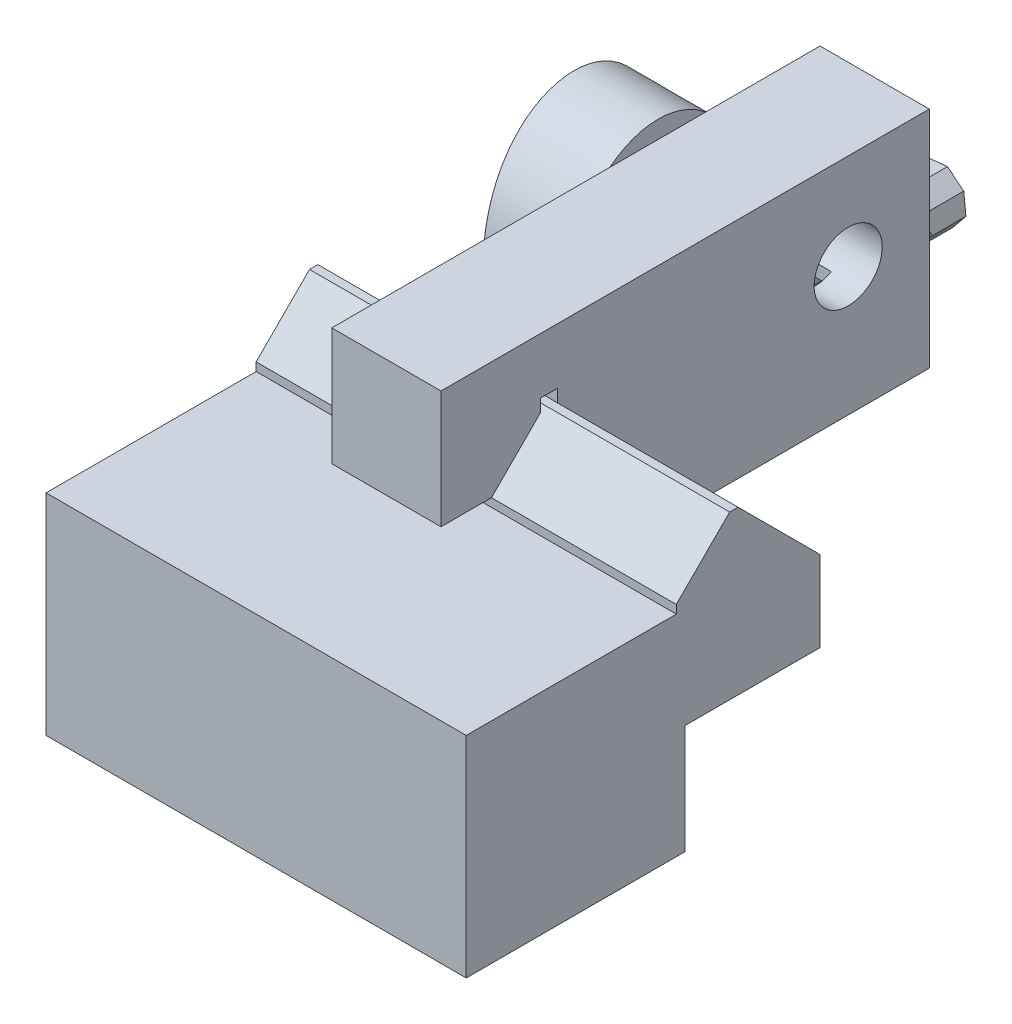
SolidWorks part; units mm, degrees
ref_plane "Top Plane" through (0, 0, 0) normal (0, 0, 1) x (1, 0, 0)
ref_plane "Front Plane" through (0, 0, 0) normal (0, 1, 0) x (1, 0, 0)
ref_plane "Right Plane" through (0, 0, 0) normal (1, 0, 0) x (0, 0, -1)
sketch "Sketch1" plane through (0, 0, 0) normal (1, 0, 0) x (0, 0, -1)
  line L0 (12.5, 12.5) -> (12.5, 13.5)
  line L7 (-12.5, 12.5) -> (12.5, 12.5)
  line L16 (-12.5, 12.5) -> (-12.5, -12.5)
  line L17 (-12.5, -12.5) -> (12.5, -12.5)
  line L18 (12.5, 12.5) -> (12.5, -12.5) construction
  line L19 (-12.5, 12.5) -> (12.5, -12.5) construction
  line L20 (-12.5, -12.5) -> (12.5, 12.5) construction
  line L21 (12.5, 13.5) -> (18.8489, 19.8489)
  line L22 (18.8489, 19.8489) -> (19.8489, 19.8489)
  line L23 (19.8489, 19.8489) -> (29.6019, 10.0958)
  line L24 (29.6019, 10.0958) -> (29.6019, 0.4958)
  line L25 (29.6019, 0.4958) -> (13.5519, 0.4958)
  line L26 (13.5519, 0.4958) -> (13.5519, -12.5)
  line L27 (12.5, -12.5) -> (13.5519, -12.5)
  line L28 (12.5, 13.5) -> (11.5, 12.5) construction
  line L29 (39.4519, 10.0958) -> (60.9519, 10.0958)
  line L30 (50.2019, 10.0958) -> (50.2019, 37.0743) construction
  line L31 (39.4519, 27.6363) -> (39.4519, -21.1762) construction
  line L32 (29.6019, 10.0958) -> (88.1638, 10.0958) construction
  spline S0 degree 3 poles (39.4519, 10.0958) (40.0358, 29.1067) (60.3681, 29.7517) (60.9519, 10.0958) knots 0 0 0 0 1 1 1 1
  point P1 (0, 0)
  point P20 (0, 0)
  dimension "D1" = 11.1
  dimension "D2" = 90
  dimension "D3" = 14.5
  dimension "D4" = 9.6
  dimension "D5" = 16.05
  dimension "D6" = 1
  dimension "D7" = 1
  dimension "D8" = 135
  dimension "D9" = 25
  dimension "D10" = 14.5
  dimension "D11" = 21.5
  dimension "D12" = 9.85
extrude "Boss-Extrude1" add sketch "Sketch1" against normal blind 10
sketch "Sketch2" plane through (0, 0, 0) normal (1, 0, 0) x (0, 0, -1)
  line L10 (-12.5, -12.5) -> (13.5519, -12.5)
  line L11 (13.5519, -12.5) -> (13.5519, 0.4958)
  line L12 (13.5519, 0.4958) -> (29.6019, 0.4958)
  line L13 (29.6019, 0.4958) -> (29.6019, 10.0958)
  line L14 (29.6019, 10.0958) -> (19.8489, 19.8489)
  line L15 (19.8489, 19.8489) -> (18.8489, 19.8489)
  line L16 (18.8489, 19.8489) -> (12.5, 13.5)
  line L17 (12.5, 13.5) -> (12.5, 12.5)
  line L18 (12.5, 12.5) -> (-12.5, 12.5)
  line L19 (-12.5, 12.5) -> (-12.5, -12.5)
  line L20 (-12.5, -12.5) -> (13.5519, -12.5)
  line L21 (13.5519, -12.5) -> (13.5519, 0.4958)
  line L22 (13.5519, 0.4958) -> (29.6019, 0.4958)
  line L23 (29.6019, 0.4958) -> (29.6019, 10.0958)
  line L24 (29.6019, 10.0958) -> (19.8489, 19.8489)
  line L25 (19.8489, 19.8489) -> (18.8489, 19.8489)
  line L26 (18.8489, 19.8489) -> (12.5, 13.5)
  line L27 (12.5, 13.5) -> (12.5, 12.5)
  line L28 (12.5, 12.5) -> (-12.5, 12.5)
  line L29 (-12.5, 12.5) -> (-12.5, -12.5)
  dimension "D1" = 0
extrude "Boss-Extrude2" add sketch "Sketch2" along normal blind 40
ref_plane "Plane1" through (5, 0, 0) normal (1, 0, 0) x (0, 0, -1)
sketch "Sketch3" plane through (5, 0, 0) normal (1, 0, 0) x (0, 0, -1)
  line L1 (39.4519, 10.0958) -> (60.9519, 10.0958)
  line L2 (39.4519, 10.0958) -> (60.9519, 10.0958) construction
  line L3 (6.5, 13.5) -> (6.5, 27.5)
  line L4 (6.5, 27.5) -> (64.6019, 27.5)
  line L6 (29.6019, 10.0958) -> (19.8489, 19.8489) construction
  line L10 (-12.5, 12.5) -> (-12.5, -12.5)
  line L11 (-12.5, -12.5) -> (13.5519, -12.5)
  line L12 (13.5519, -12.5) -> (13.5519, 0.4958)
  line L13 (13.5519, 0.4958) -> (29.6019, 0.4958)
  line L14 (29.6019, 0.4958) -> (29.6019, 10.0958)
  line L15 (29.6019, 10.0958) -> (19.8489, 19.8489)
  line L16 (19.8489, 19.8489) -> (18.8489, 19.8489)
  line L17 (18.8489, 19.8489) -> (12.5, 13.5)
  line L18 (12.5, 13.5) -> (12.5, 12.5)
  line L19 (12.5, 12.5) -> (-12.5, 12.5)
  line L20 (-12.5, 12.5) -> (-12.5, -12.5) construction
  line L21 (-12.5, -12.5) -> (13.5519, -12.5) construction
  line L22 (13.5519, -12.5) -> (13.5519, 0.4958) construction
  line L23 (13.5519, 0.4958) -> (29.6019, 0.4958) construction
  line L24 (29.6019, 0.4958) -> (29.6019, 10.0958) construction
  line L25 (29.6019, 10.0958) -> (19.8489, 19.8489) construction
  line L26 (19.8489, 19.8489) -> (18.8489, 19.8489) construction
  line L27 (18.8489, 19.8489) -> (12.5, 13.5) construction
  line L28 (12.5, 13.5) -> (12.5, 12.5) construction
  line L29 (12.5, 12.5) -> (-12.5, 12.5) construction
  line L30 (29.6019, 10.0958) -> (29.6019, 0.7958)
  line L31 (29.6019, 0.7958) -> (64.6019, 0.7958)
  line L32 (64.6019, 0.7958) -> (64.6019, 27.5)
  line L34 (12.5, 13.5) -> (6.5, 13.5)
  line L36 (18.3489, 19.3489) -> (18.3489, 20.8489)
  line L38 (29.6019, 10.0958) -> (20.3489, 19.3489)
  line L39 (20.3489, 19.3489) -> (20.3489, 20.8489)
  line L40 (19.3489, 19.8489) -> (19.3489, 21.4507) construction
  line L41 (18.3489, 20.8489) -> (19.3489, 20.8489)
  line L42 (19.3489, 20.8489) -> (20.3489, 20.8489)
  line L43 (12.5, 13.5) -> (18.3489, 19.3489)
  circle A0 centre (54.9519, 16.0958) radius 4.05
  spline S1 degree 3 poles (-5602.293, -1875.6467) (5973.4925, 861.5399) (-5925.3022, 272.9298) (5853.6063, -1331.3264) knots -4.781302 -4.781302 -4.781302 -4.781302 5.827 5.827 5.827 5.827 only from (60.9519, 10.0958) to (39.4519, 10.0958)
  spline S2 degree 3 poles (60.9519, 10.0958) (60.3681, 29.7517) (40.0358, 29.1067) (39.4519, 10.0958) knots 0 0 0 0 1 1 1 1 construction
  dimension "D3" = 8.1
  dimension "D4" = 6
  dimension "D5" = 6
  dimension "D6" = 1
  dimension "D7" = 2
  dimension "D8" = 1
  dimension "D9" = 35
  dimension "D10" = 0.3
  dimension "D11" = 14
  dimension "D12" = 6
  dimension "D1" = 0
  dimension "D2" = 0
extrude "Boss-Extrude3" add sketch "Sketch3" along normal blind 13 separate body
sketch "Sketch4" plane through (0, 0.7958, 0) normal (0, -1, 0) x (1, 0, 0)
  line L0 (18, -59.0019) -> (18, -50.9019) construction
  line L1 (18, -59.0019) -> (18, -50.9019) construction
  line L3 (14, -52.9519) -> (5, -52.9519)
  line L4 (14, -52.9519) -> (14, -56.9519)
  line L5 (14, -56.9519) -> (5, -56.9519)
  line L6 (5, -52.9519) -> (5, -56.9519)
  line L7 (13.3742, -54.9519) -> (5.6258, -54.9519) construction
  line L8 (9.5, -52.9519) -> (9.5, -54.9519) construction
  line L9 (9.5, -54.9519) -> (9.5, -56.9519) construction
  line L11 (5, -29.6019) -> (5, -64.6019) construction
  point P6 (7.3699, -56.9519)
  point P12 (0, 0)
  point P14 (18, -54.9519)
  dimension "D1" = 4
  dimension "D2" = 4
extrude "Cut-Extrude1" cut sketch "Sketch4" against normal up to surface (11.7783 mm away)
sketch "Sketch5" plane through (5, 0, 0) normal (1, 0, 0) x (0, 0, -1)
  line L1 (52.9519, 19.6176) -> (52.9519, 0.7958) construction
  line L2 (56.9519, 19.6176) -> (56.9519, 0.7958) construction
  line L3 (52.9519, 19.6176) -> (52.9519, 0.7958) construction
  line L4 (64.6019, 0.7958) -> (64.6019, 27.5) construction
  line L6 (64.6019, 11.0458) -> (48.9519, 11.0458)
  line L11 (64.6019, 11.0458) -> (64.6019, 8.0458)
  line L12 (64.6019, 8.0458) -> (48.9519, 8.0458)
  line L13 (48.9519, 11.0458) -> (48.9519, 8.0458)
  line L14 (63.1124, 12.0458) -> (43.0318, 12.0458) construction
  arc A0 (52.9519, 12.5741) -> (56.9519, 12.5741) centre (54.9519, 16.0958) ccw construction
  arc A1 (52.9519, 12.5741) -> (56.9519, 12.5741) centre (54.9519, 16.0958) ccw
  dimension "D1" = 1
  dimension "D2" = 4
  dimension "D3" = 3
extrude "Cut-Extrude3" cut sketch "Sketch5" along normal blind 8.5
ref_plane "Plane2" through (0, 0, -53.2519) normal (0, 0, -1) x (-1, 0, 0)
sketch "Sketch7" plane through (0, 0, -53.2519) normal (0, 0, -1) x (-1, 0, 0)
  line L0 (-14, 12.0458) -> (-14, 12.5741) construction
  line L1 (-14, 12.0458) -> (-14, 12.5741) construction
  line L2 (-13.5, 11.0458) -> (-13.5, 8.0458) construction
  line L3 (-13.2853, 12.8458) -> (-8.9878, 12.8458) construction
  line L4 (-13.5, 11.0458) -> (-13.5, 8.0458) construction
  line L5 (-13.5, 8.0458) -> (-5, 8.0458) construction
  line L6 (-13.5, 11.0458) -> (-5, 11.0458) construction
  line L7 (-13.5, 8.0458) -> (-5, 8.0458) construction
  line L8 (-9.25, 12.8458) -> (-9.25, 6.8458) construction
  line L9 (-13.5, 11.0458) -> (-5, 11.0458) construction
  line L10 (-14, 12.0458) -> (-3.0587, 12.0458) construction
  circle A0 centre (-9.25, 9.8458) radius 3
  circle A1 centre (-9.25, 9.5458) radius 1.5
  point P10 (-9.25, 8.0458)
  point P14 (-9.25, 9.8458)
  dimension "D2" = 6
  dimension "D3" = 3
  dimension "D1" = 0.8
extrude "Boss-Extrude5" add sketch "Sketch7" along normal offset from surface (3.4 mm away) 0.3 separate body
sketch "Sketch8" plane through (0, 0, -53.2519) normal (0, 0, 1) x (1, 0, 0)
  circle A0 centre (9.25, 9.5458) radius 1.5 construction
  circle A1 centre (9.25, 9.5458) radius 1.5
extrude "Boss-Extrude6" add sketch "Sketch8" against normal offset from surface (17.35 mm away) 6
sketch "Sketch9" plane through (0, 0, -70.6019) normal (0, 0, -1) x (-1, 0, 0)
  line L0 (-10.8, 6.6925) -> (-8.3284, 6.4322)
  line L1 (-6.3967, 7.9958) -> (-6.1363, 10.4674)
  line L2 (-6.1363, 10.4674) -> (-7.7, 12.3992)
  line L3 (-7.7, 12.3992) -> (-10.1716, 12.6595)
  line L4 (-10.1716, 12.6595) -> (-12.1033, 11.0959)
  line L5 (-12.1033, 11.0959) -> (-12.3637, 8.6243)
  line L6 (-12.3637, 8.6243) -> (-10.8, 6.6925)
  line L7 (-8.3284, 6.4322) -> (-6.3967, 7.9958)
  circle A0 centre (-9.25, 9.5458) radius 3 construction
  dimension "D1" = 6
extrude "Boss-Extrude7" add sketch "Sketch9" along normal blind 4
chamfer "Chamfer1" distance 3 angle 30 1 edges at (10.75, 9.5458, -70.6019)
